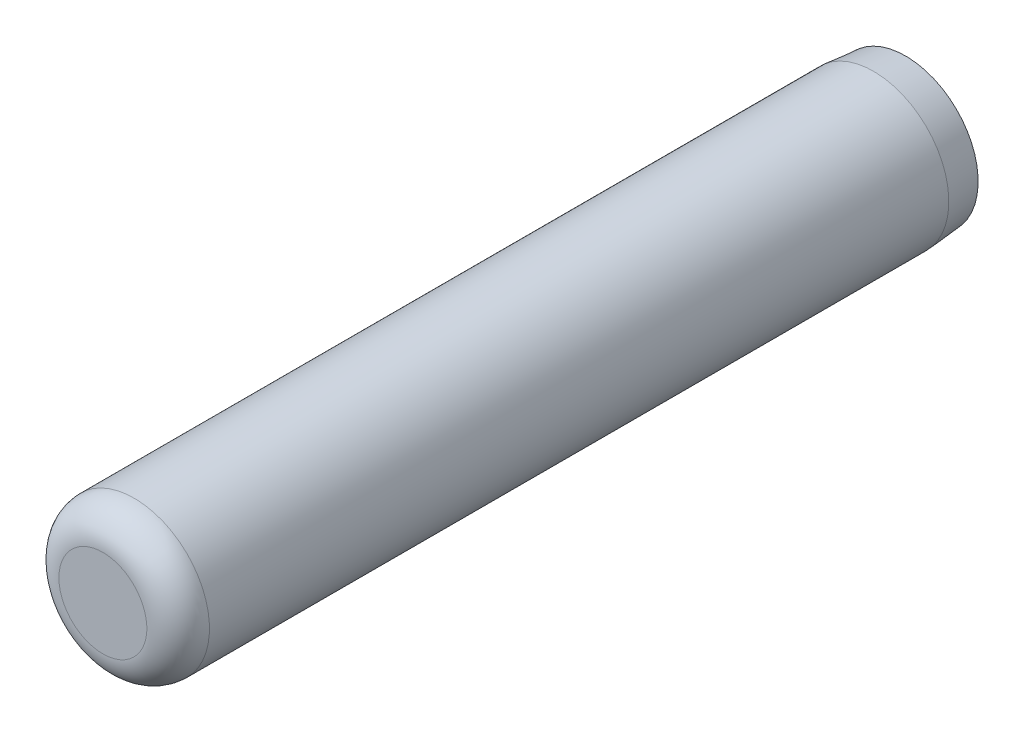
SolidWorks part; units mm, degrees
ref_plane "Front" through (0, 0, 0) normal (0, 0, 1) x (1, 0, 0)
ref_plane "Top" through (0, 0, 0) normal (0, 1, 0) x (1, 0, 0)
ref_plane "Right" through (0, 0, 0) normal (1, 0, 0) x (0, 0, -1)
sketch "Logo3_Revol_Axis" plane through (0, 0, 0) normal (0, 1, 0) x (1, 0, 0)
  line L0 (0, -30.1653) -> (0, 30.1653) construction
sketch "Logo3_bib1" plane through (0, 0, 0) normal (0, -1, 0) x (-1, 0, 0)
  line L0 (0, 19.05) -> (0, -31.75)
  line L1 (4.7625, 17.7739) -> (4.7625, -30.4739) construction
  line L2 (4.7625, -29.7688) -> (4.7625, 17.018)
  line L3 (0, 19.05) -> (4.5847, 19.05)
  line L4 (4.7625, 17.018) -> (4.5847, 19.05)
  line L5 (0, -31.75) -> (2.7813, -31.75)
  line L10 (0, 47.5372) -> (0, -34.1764) construction
  arc A0 (4.7625, 17.7739) -> (0, 19.05) centre (0, 9.525) ccw construction
  arc A1 (0, -31.75) -> (4.7625, -30.4739) centre (0, -22.225) ccw construction
  arc A2 (2.7813, -31.75) -> (4.7625, -29.7688) centre (2.7813, -29.7688) ccw
revolve "Revolve1" add sketch "Logo3_bib1" angle 360 about L10
equation "\"ray2@Logo3_bib1\" = \"logo3_d1@Logo3_bib1\""
equation "\"Ray1@Logo3_bib1\" = \"logo3_d1@Logo3_bib1\""
equation "\"dia1@Logo3_bib1\" = \"logo3_d1@Logo3_bib1\"/2"
